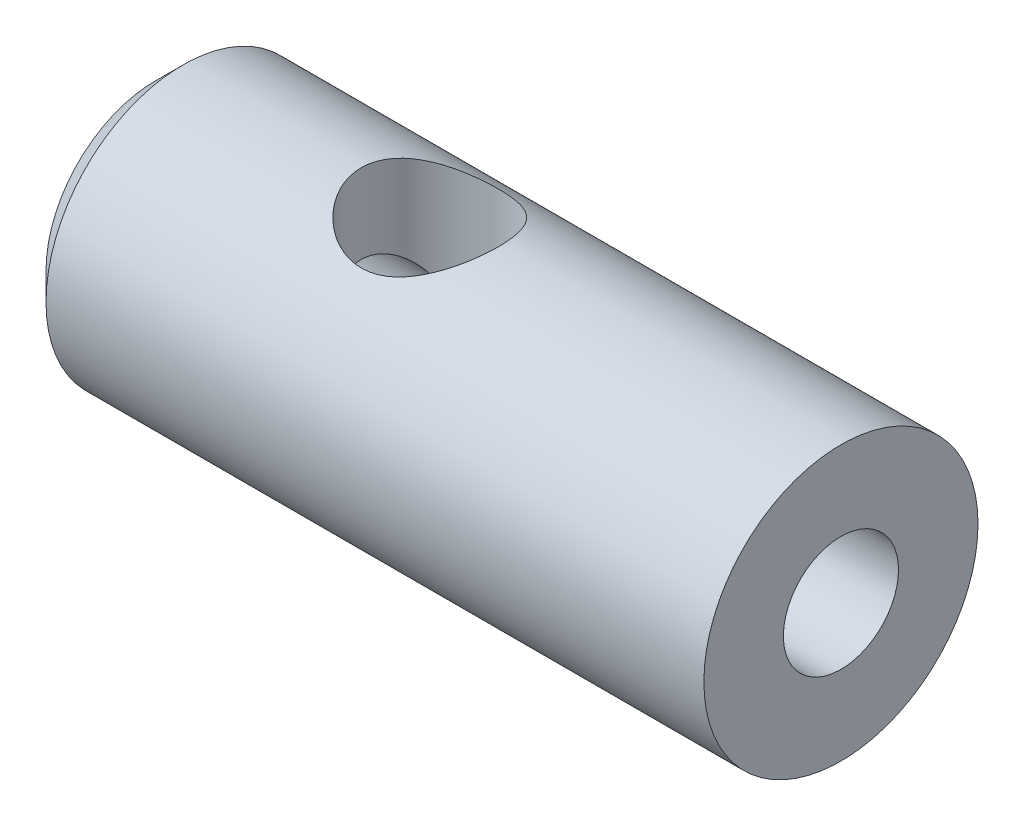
SolidWorks part; units mm, degrees
ref_plane "Front Plane" through (0, 0, 0) normal (0, 0, 1) x (1, 0, 0)
ref_plane "Top Plane" through (0, 0, 0) normal (0, 1, 0) x (1, 0, 0)
ref_plane "Right Plane" through (0, 0, 0) normal (1, 0, 0) x (0, 0, -1)
sketch "Sketch1" plane through (0, 0, 0) normal (0, 0, 1) x (1, 0, 0)
  line L1 (0, 0) -> (25, 0)
  line L2 (0, 0) -> (0, 5)
  line L3 (0, 5) -> (25, 5)
  line L4 (25, 0) -> (25, 5)
  dimension "D1" = 25
  dimension "D2" = 5
revolve "Revolve1" add sketch "Sketch1" angle 360 about L3
sketch "Sketch2" plane through (25, 0, 0) normal (1, 0, 0) x (0, 0, -1)
  point P0 (0, 5)
hole_wizard "M5 Tapped Hole2" positions "3DSketch2" profile "Sketch5" tap size "M5" standard "ISO"
sketch3d "3DSketch2"
  point P0 (25, 5, 0)
sketch "Sketch5" plane through (25, 5, 0) normal (0, 1, 0) x (0, 0, -1)
  line L0 (0, 0) -> (0, 25)
  line L1 (0, 25) -> (2.1, 25)
  line L2 (2.1, 25) -> (2.1, 0)
  line L5 (2.1, 0) -> (0, 0)
  line L11 (0, -6.35) -> (0, 107.95) construction
  dimension "Thru Tap Drill Dia." = 4.2
  dimension "Thru Tap Drill Depth" = 25
sketch "Sketch6" plane through (0, 0, 0) normal (0, 1, 0) x (1, 0, 0)
  line L0 (0, 0) -> (25, 0) construction
  line L1 (25, -5) -> (25, 5) construction
  line L2 (0, 5) -> (0, -5) construction
  circle A0 centre (10, 0) radius 2.5
  dimension "D2" = 5
  dimension "D1" = 10
extrude "Extrude1" cut sketch "Sketch6" along normal through all
chamfer "Chamfer1" distance 1 angle 45 1 edges at (0, 5, 5)
